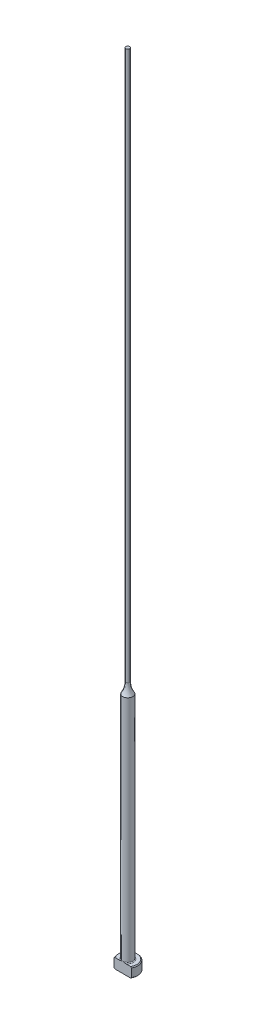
SolidWorks part; units mm, degrees
ref_plane "Front Plane" through (0, 0, 0) normal (0, 0, 1) x (1, 0, 0)
ref_plane "Top Plane" through (0, 0, 0) normal (0, 1, 0) x (1, 0, 0)
ref_plane "Right Plane" through (0, 0, 0) normal (1, 0, 0) x (0, 0, -1)
sketch "Sketch1" plane through (0, 0, 0) normal (0, 0, 1) x (1, 0, 0)
  line L0 (0, 259.9588) -> (0, -15.1925) construction
  line L1 (0, 0) -> (-3.175, 0)
  line L2 (-3.175, 0) -> (-3.175, 3.175)
  line L3 (-3.175, 3.175) -> (-1.5875, 3.175)
  line L4 (-0.5944, 79.6098) -> (-0.5944, 254)
  line L5 (-0.5944, 254) -> (0, 254)
  line L6 (0, 254) -> (0, 0)
  line L7 (-1.5875, 3.175) -> (-1.5875, 76.2)
  arc A0 (-1.5875, 76.2) -> (-0.5944, 79.6098) centre (-6.9444, 79.6098) ccw
  point P13 (-1.5875, 0)
  dimension "D1" = 6.35
  dimension "L" = 254
  dimension "D2" = 3.175
  dimension "H" = 6.35
  dimension "T" = 3.175
  dimension "D" = 1.1887
  dimension "S" = 76.2
revolve "Revolve1" add sketch "Sketch1" angle 360 about L0
chamfer "Chamfer1" distance 0.254 angle 45 2 edges at (0, 3.175, 3.175) (0, 0, 3.175)
fillet "Fillet1" radius 0.254 1 edges at (0, 3.175, 1.5875)
sketch "Sketch2" plane through (0, 0, 0) normal (0, -1, 0) x (1, 0, 0)
  line L0 (-2.7496, 1.5875) -> (2.7496, 1.5875)
  arc A0 (2.7496, 1.5875) -> (-2.7496, 1.5875) centre (0, 0) ccw
  circle A1 centre (0, 0) radius 3.175 construction
  circle A2 centre (0, 0) radius 1.5875 construction
extrude "Cut-Extrude1" cut sketch "Sketch2" against normal through all
